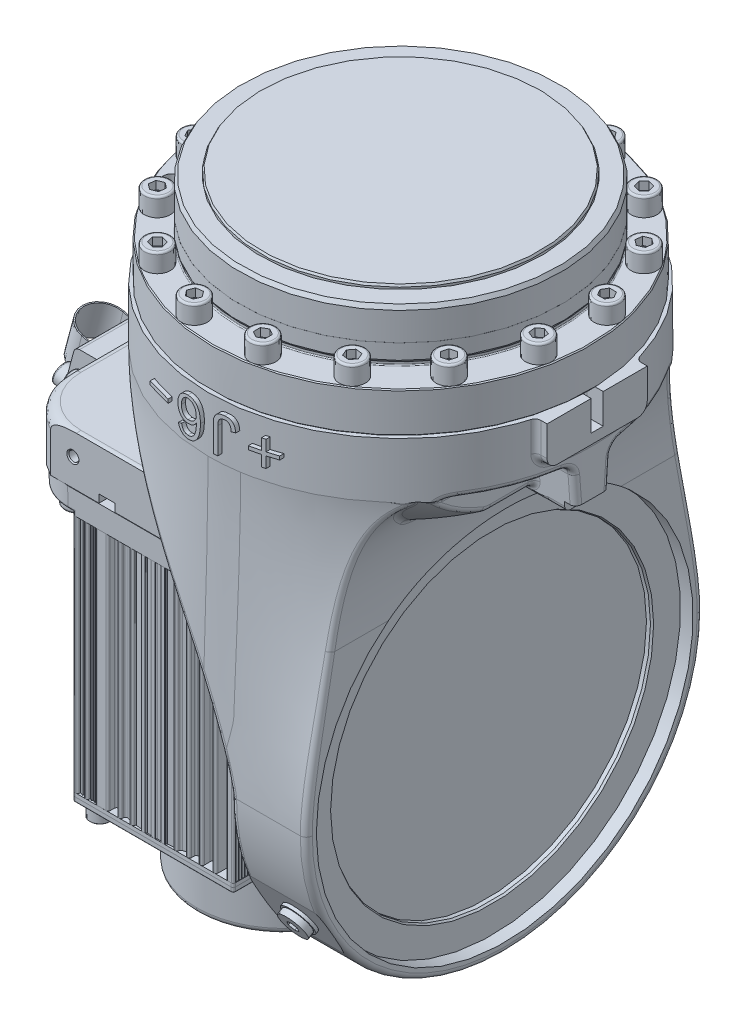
SolidWorks part; units mm, degrees
ref_plane "前视基准面" through (0, 0, 0) normal (0, 0, 1) x (1, 0, 0)
ref_plane "上视基准面" through (0, 0, 0) normal (0, 1, 0) x (1, 0, 0)
ref_plane "右视基准面" through (0, 0, 0) normal (1, 0, 0) x (0, 0, -1)
imported_body "腕部装配-1-solid1"
sketch "草图2" plane through (0, 43, 0) normal (0, -1, 0) x (1, 0, 0)
  line L0 (-123.5, -27) -> (-138.5, -27) construction
  line L1 (-123.5, 27) -> (-124.5, 27)
  line L2 (-123.5, 27) -> (-123.5, -27)
  line L3 (-123.5, -27) -> (-124.5, -27)
  line L4 (-124.5, 27) -> (-124.5, -27)
  dimension "D1" = 1
extrude "切除-拉伸1" cut sketch "草图2" against normal blind 20
sketch "草图1" plane through (0, 59.5, 0) normal (0, -1, 0) x (1, 0, 0)
  line L1 (-124.7136, 65.8605) -> (7.7136, 65.8605)
  line L2 (-124.7136, 65.8605) -> (-124.7136, -65.8605)
  line L3 (-124.7136, -65.8605) -> (7.7136, -65.8605)
  line L4 (7.7136, 65.8605) -> (7.7136, -65.8605)
  line L5 (-124.7136, 65.8605) -> (7.7136, -65.8605) construction
  line L6 (-124.7136, -65.8605) -> (7.7136, 65.8605) construction
  point P0 (-58.5, 0)
surface "曲面-基准面1" sketch "草图1"
split "分割2" trim tools "曲面-基准面1" bodies to split 125 resulting bodies 126 127
